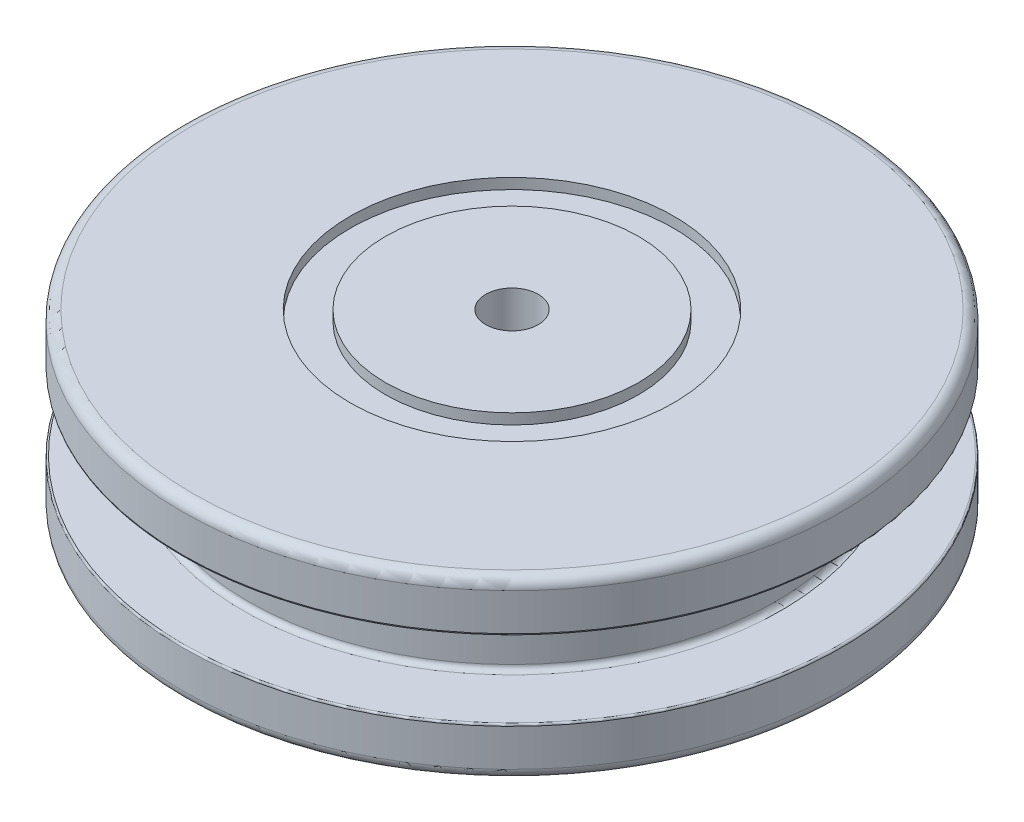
SolidWorks part; units mm, degrees
ref_plane "Front Plane" through (0, 0, 0) normal (0, 0, 1) x (1, 0, 0)
ref_plane "Top Plane" through (0, 0, 0) normal (0, 1, 0) x (1, 0, 0)
ref_plane "Right Plane" through (0, 0, 0) normal (1, 0, 0) x (0, 0, -1)
sketch "Sketch1" plane through (0, 0, 0) normal (0, 0, 1) x (1, 0, 0)
  line L0 (0, 0) -> (0, 31.826) construction
  line L1 (-20.6248, 0) -> (-23.0378, 0)
  line L2 (-23.7998, 0.762) -> (-23.7998, 11.938)
  line L3 (-23.0378, 12.7) -> (0, 12.7)
  line L5 (0, 12.7) -> (0, 0)
  line L9 (-5.08, 0) -> (0, 0)
  line L10 (-20.6248, 0) -> (-13.7487, 6.8761)
  line L11 (-11.9527, 7.62) -> (-8.0741, 7.62)
  line L12 (-5.08, 0) -> (-5.5438, 5.3014)
  line L14 (0, 7.62) -> (-3.175, 7.62) construction
  line L15 (0, 7.62) -> (0, 0) construction
  line L16 (0, 0) -> (-3.175, 0) construction
  line L17 (-3.175, 7.62) -> (-3.175, 0) construction
  arc A0 (-23.0378, 0) -> (-23.7998, 0.762) centre (-23.0378, 0.762) cw
  arc A1 (-23.7998, 11.938) -> (-23.0378, 12.7) centre (-23.0378, 11.938) cw
  arc A2 (-13.7487, 6.8761) -> (-11.9527, 7.62) centre (-11.9527, 5.08) cw
  arc A3 (-5.5438, 5.3014) -> (-8.0741, 7.62) centre (-8.0741, 5.08) ccw
  point P9 (-23.7998, 0)
  dimension "D5" = 0.762
  dimension "D3" = 0.762
  dimension "D7" = 2.54
  dimension "D1" = 12.7
  dimension "D2" = 10.16
  dimension "D4" = 47.5996
  dimension "D6" = 95
  dimension "D8" = 3.175
  dimension "D9" = 5.08
  dimension "D10" = 135
  dimension "D11" = 3.175
  dimension "D12" = 7.62
revolve "Revolve1" add sketch "Sketch1" angle 360 about L0
sketch "Sketch2" plane through (0, 0, 0) normal (0, 1, 0) x (1, 0, 0)
  circle A0 centre (0, 0) radius 3.175
extrude "screw hole" cut sketch "Sketch2" along normal up to vertex (7.62 mm away)
sketch "Sketch3" plane through (0, 12.7, 0) normal (0, 1, 0) x (1, 0, 0)
  circle A0 centre (0, 0) radius 9.144
  circle A1 centre (0, 0) radius 11.684
  dimension "D1" = 18.288
  dimension "D2" = 23.368
extrude "spring groove" cut sketch "Sketch3" against normal blind 0.762
sketch "Sketch5" plane through (0, 0, 0) normal (0, 0, 1) x (1, 0, 0)
  line L0 (-23.7998, 11.938) -> (-23.7998, 0.762) construction
  line L1 (-23.7998, 9.1186) -> (-19.431, 9.1186)
  line L2 (-23.7998, 9.1186) -> (-23.7998, 3.5814)
  line L3 (-23.7998, 3.5814) -> (-19.431, 3.5814)
  line L4 (-19.05, 8.7376) -> (-19.05, 3.9624)
  line L5 (23.7998, 6.35) -> (-9.4659, 6.35) construction
  line L6 (23.7998, 0.762) -> (23.7998, 11.938) construction
  line L7 (-19.05, 6.35) -> (-16.647, 6.35) construction
  line L8 (0, 0) -> (0, 13.081) construction
  arc A0 (-19.431, 3.5814) -> (-19.05, 3.9624) centre (-19.431, 3.9624) ccw
  arc A1 (-19.431, 9.1186) -> (-19.05, 8.7376) centre (-19.431, 8.7376) cw
  dimension "D3" = 0.381
  dimension "D1" = 5.5372
  dimension "D2" = 38.1
revolve "cupseal" cut sketch "Sketch5" angle 360 about L8
sketch "Sketch6" plane through (0, 12.7, 0) normal (0, 1, 0) x (1, 0, 0)
  point P0 (0, 0)
hole_wizard "#6 Clearance Hole1" positions "Sketch6" profile "Sketch7" hole size "#6" standard "ANSI Inch"
sketch "Sketch7" plane through (0, 12.7, 0) normal (1, 0, 0) x (0, 0, 1)
  line L0 (0, 0) -> (0, 15.6188)
  line L1 (0, 15.6188) -> (1.8986, 14.478)
  line L2 (1.8986, 14.478) -> (1.8986, 0)
  line L5 (1.8986, 0) -> (0, 0)
  line L10 (0, 15.6188) -> (-1.8987, 14.478) construction
  line L11 (0, -6.35) -> (0, 107.95) construction
  dimension "Hole Dia." = 3.7973
  dimension "Hole Depth" = 14.478
  dimension "Drill Angle" = 118
fillet "break_edge" radius 0.127 2 edges at (0, 9.1186, -23.7998) (0, 3.5814, -23.7998)
